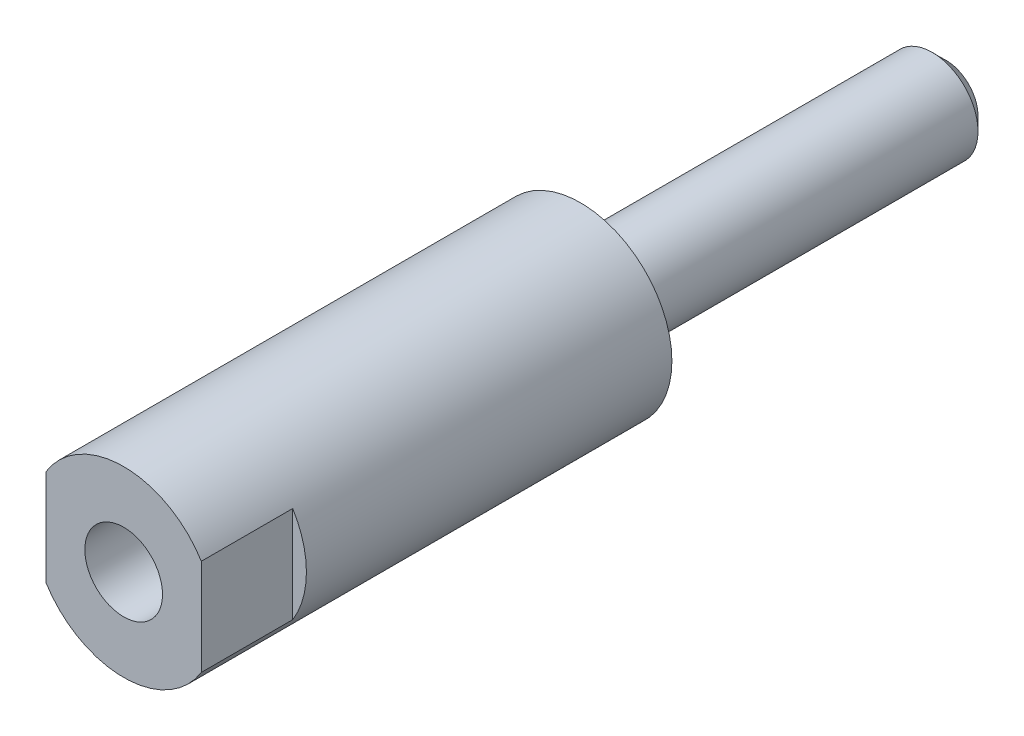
SolidWorks part; units mm, degrees
ref_plane "Plan de face" through (0, 0, 0) normal (0, 0, 1) x (1, 0, 0)
ref_plane "Plan de dessus" through (0, 0, 0) normal (0, 1, 0) x (1, 0, 0)
ref_plane "Plan de droite" through (0, 0, 0) normal (1, 0, 0) x (0, 0, -1)
sketch "Esquisse1" plane through (0, 0, 0) normal (0, 0, 1) x (1, 0, 0)
  circle A0 centre (0, 0) radius 10
  dimension "D1" = 20
extrude "Extrusion1" add sketch "Esquisse1" along normal blind 50
sketch "Esquisse2" plane through (0, 0, 0) normal (0, 0, -1) x (-1, 0, 0)
  circle A0 centre (0, 0) radius 5
  dimension "D1" = 10
extrude "Extrusion2" add sketch "Esquisse2" along normal blind 40
hole_wizard "Trou taraudé M101" positions "Esquisse4" profile "Esquisse3" tap size "M10" standard "ISO"
sketch "Esquisse4" plane through (0, 0, 50) normal (0, 0, 1) x (1, 0, 0)
  point P0 (0, 0)
sketch "Esquisse3" plane through (0, 0, 50) normal (1, 0, 0) x (0, -1, 0)
  line L0 (0, 0) -> (0, 37.5537)
  line L1 (0, 37.5537) -> (4.25, 35)
  line L2 (4.25, 35) -> (4.25, 0)
  line L5 (4.25, 0) -> (0, 0)
  line L10 (0, 37.5537) -> (-4.25, 35) construction
  line L11 (0, -6.35) -> (0, 107.95) construction
  dimension "Diamètre du trou pour taraudage" = 8.5
  dimension "Profondeur du trou pour taraudage" = 35
  dimension "Angle de pointe" = 118
sketch "Esquisse5" plane through (0, 0, 50) normal (0, 0, 1) x (1, 0, 0)
  line L0 (-8.5, 5.2678) -> (-8.5, -5.2678)
  line L1 (8.5, 5.2678) -> (8.5, -5.2678)
  circle A0 centre (0, 0) radius 10 construction
  arc A1 (-8.5, 5.2678) -> (-8.5, -5.2678) centre (0, 0) ccw
  arc A2 (8.5, -5.2678) -> (8.5, 5.2678) centre (0, 0) ccw
  dimension "D1" = 17
extrude "Enlèv. mat.-Extru.1" cut sketch "Esquisse5" against normal blind 10
chamfer "Chanfrein1" distance 1.5 angle 45 1 edges at (-5, 0, -40)
